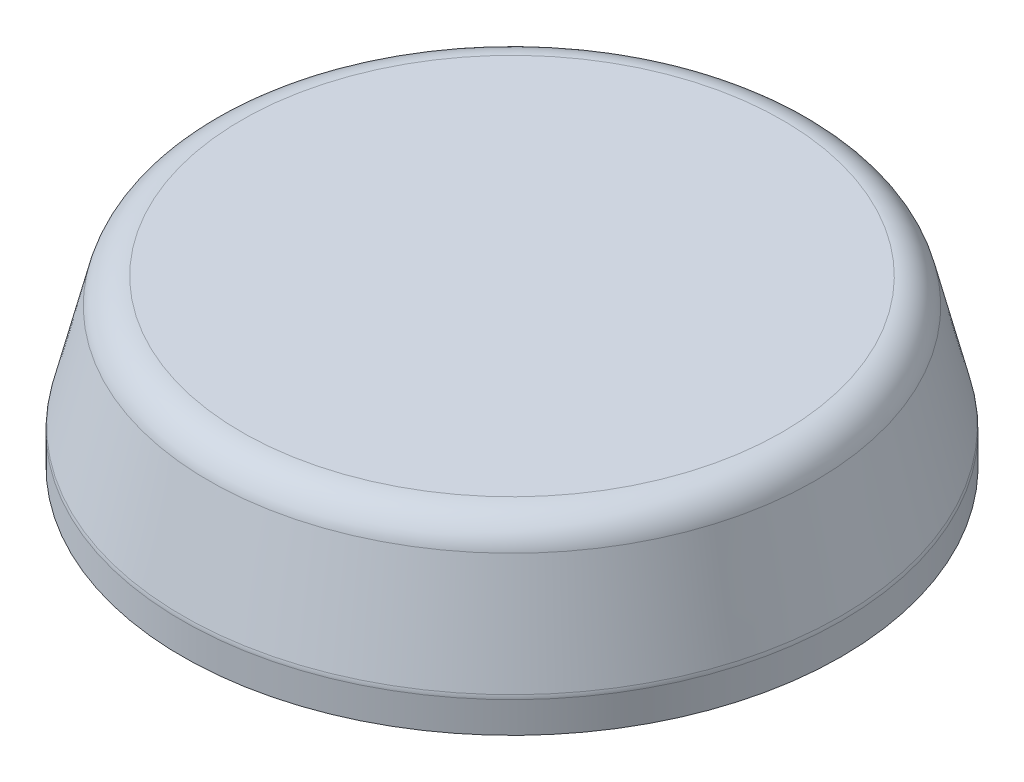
SolidWorks part; units mm, degrees
ref_plane "Front Plane" through (0, 0, 0) normal (0, 0, 1) x (1, 0, 0)
ref_plane "Top Plane" through (0, 0, 0) normal (0, 1, 0) x (1, 0, 0)
ref_plane "Right Plane" through (0, 0, 0) normal (1, 0, 0) x (0, 0, -1)
sketch "Sketch1" plane through (0, 0, 0) normal (0, 0, 1) x (1, 0, 0)
  line L0 (0, 0) -> (0, 127) construction
  line L1 (-121.92, 0) -> (-127, 0)
  line L2 (-127, 0) -> (-127, 11.9231)
  line L3 (-126.8127, 13.454) -> (-116.84, 53.6009)
  line L4 (-121.92, 0) -> (-121.92, 11.9231)
  line L5 (-104.181, 63.5) -> (0, 63.5)
  line L6 (-121.7327, 13.454) -> (-111.76, 53.6009)
  line L7 (-105.5973, 58.42) -> (0, 58.42)
  line L8 (0, 58.42) -> (0, 63.5)
  arc A0 (-111.76, 53.6009) -> (-105.5973, 58.42) centre (-105.5973, 52.07) cw
  arc A1 (-116.84, 53.6009) -> (-104.181, 63.5) centre (-104.181, 50.4563) cw
  arc A2 (-121.92, 11.9231) -> (-121.7327, 13.454) centre (-115.57, 11.9231) cw
  arc A3 (-127, 11.9231) -> (-126.8127, 13.454) centre (-120.65, 11.9231) cw
  point P17 (-121.92, 12.7)
  point P20 (-127, 12.7)
  dimension "D7" = 6.35
  dimension "D8" = 6.35
  dimension "D1" = 12.7
  dimension "D2" = 10.16
  dimension "D3" = 254
  dimension "D4" = 5.08
  dimension "D5" = 5.08
  dimension "D6" = 63.5
revolve "Revolve1" add sketch "Sketch1" angle 360 about L0
